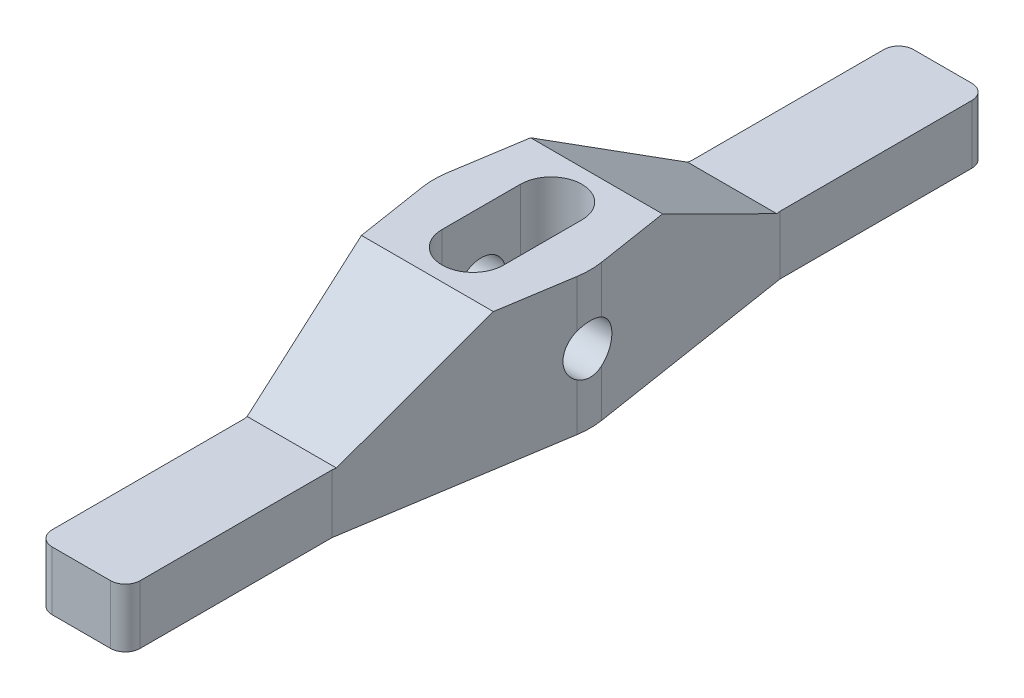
SolidWorks part; units mm, degrees
ref_plane "Front Plane" through (0, 0, 0) normal (0, 0, 1) x (1, 0, 0)
ref_plane "Top Plane" through (0, 0, 0) normal (0, 1, 0) x (1, 0, 0)
ref_plane "Right Plane" through (0, 0, 0) normal (1, 0, 0) x (0, 0, -1)
sketch "Sketch1" plane through (0, 0, 0) normal (0, 1, 0) x (1, 0, 0)
  line L0 (0, 0) -> (68.8474, 0) construction
  line L1 (0, 0) -> (0, 75.643) construction
  line L2 (-14.2875, 139.7) -> (14.2875, 139.7)
  line L3 (14.2875, 139.7) -> (14.2875, 72.6186)
  line L4 (14.2875, 72.6186) -> (25.0914, 3.9476)
  line L6 (14.2875, -72.6186) -> (25.0914, -3.9476)
  line L7 (14.2875, -139.7) -> (14.2875, -72.6186)
  line L8 (-14.2875, -139.7) -> (14.2875, -139.7)
  line L9 (-14.2875, -139.7) -> (-14.2875, -72.6186)
  line L10 (-14.2875, -72.6186) -> (-25.0914, -3.9476)
  line L12 (-14.2875, 72.6186) -> (-25.0914, 3.9476)
  line L13 (-14.2875, 139.7) -> (-14.2875, 72.6186)
  line L14 (-9.9949, 12.7) -> (-9.9949, -12.7)
  line L15 (9.9949, 12.7) -> (9.9949, -12.7)
  arc A0 (9.9949, 12.7) -> (-9.9949, 12.7) centre (0, 12.7) ccw
  arc A1 (-9.9949, -12.7) -> (9.9949, -12.7) centre (0, -12.7) ccw
  arc A2 (25.0914, -3.9476) -> (25.0914, 3.9476) centre (0, 0) ccw
  arc A3 (-25.0914, 3.9476) -> (-25.0914, -3.9476) centre (0, 0) ccw
  dimension "D3" = 50.8
  dimension "D1" = 28.575
  dimension "D2" = 279.4
  dimension "D4" = 67.0814
  dimension "D6" = 25.4
  dimension "D7" = 19.9898
extrude "Extrude1" add sketch "Sketch1" along normal blind 44.45
sketch "Sketch2" plane through (0, 0, 0) normal (1, 0, 0) x (0, 0, -1)
  line L0 (0, 0) -> (0, 25.2428) construction
  line L2 (139.7, 44.45) -> (27.432, 44.45)
  line L3 (3.9476, 44.45) -> (72.6186, 44.45) construction
  line L4 (27.432, 44.45) -> (71.4261, 19.05)
  line L5 (71.4261, 19.05) -> (139.7, 19.05)
  line L6 (139.7, 44.45) -> (139.7, 0) construction
  line L7 (139.7, 19.05) -> (139.7, 44.45)
  line L8 (72.6186, 0) -> (139.7, 0) construction
  line L9 (-139.7, 19.05) -> (-139.7, 44.45)
  line L10 (-71.4261, 19.05) -> (-139.7, 19.05)
  line L11 (-27.432, 44.45) -> (-71.4261, 19.05)
  line L12 (-139.7, 44.45) -> (-27.432, 44.45)
  dimension "D1" = 27.432
  dimension "D2" = 30
  dimension "D3" = 19.05
extrude "Cut-Extrude1" cut sketch "Sketch2" against normal through all and the other way through all
sketch "Sketch3" plane through (0, 0, 0) normal (1, 0, 0) x (0, 0, -1)
  line L1 (-72.6186, 0) -> (-3.9476, 0) construction
  circle A0 centre (0, 22.225) radius 7.9311
  dimension "D1" = 15.8623
  dimension "D2" = 22.225
extrude "Cut-Extrude2" cut sketch "Sketch3" against normal through all and the other way through all
fillet "Fillet1" radius 4.826 4 edges at (-14.2875, 9.525, -139.7) (14.2875, 9.525, -139.7) (-14.2875, 9.525, 139.7) (14.2875, 9.525, 139.7)
